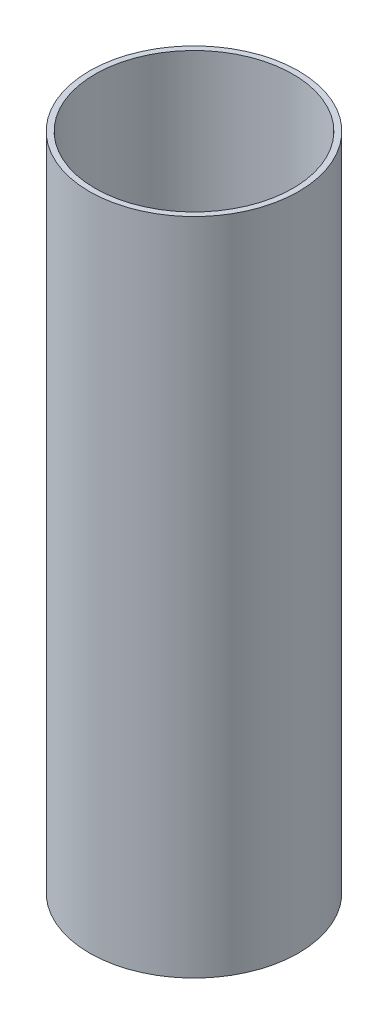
SolidWorks part; units mm, degrees
ref_plane "Front Plane" through (0, 0, 0) normal (0, 0, 1) x (1, 0, 0)
ref_plane "Top Plane" through (0, 0, 0) normal (0, 1, 0) x (1, 0, 0)
ref_plane "Right Plane" through (0, 0, 0) normal (1, 0, 0) x (0, 0, -1)
sketch "Sketch1" plane through (0, 0, 0) normal (0, 1, 0) x (1, 0, 0)
  circle A0 centre (0, 0) radius 76.2
  circle A1 centre (0, 0) radius 80.518
  dimension "D1" = 152.4
  dimension "D2" = 4.318
extrude "Boss-Extrude1" add sketch "Sketch1" along normal blind 508
